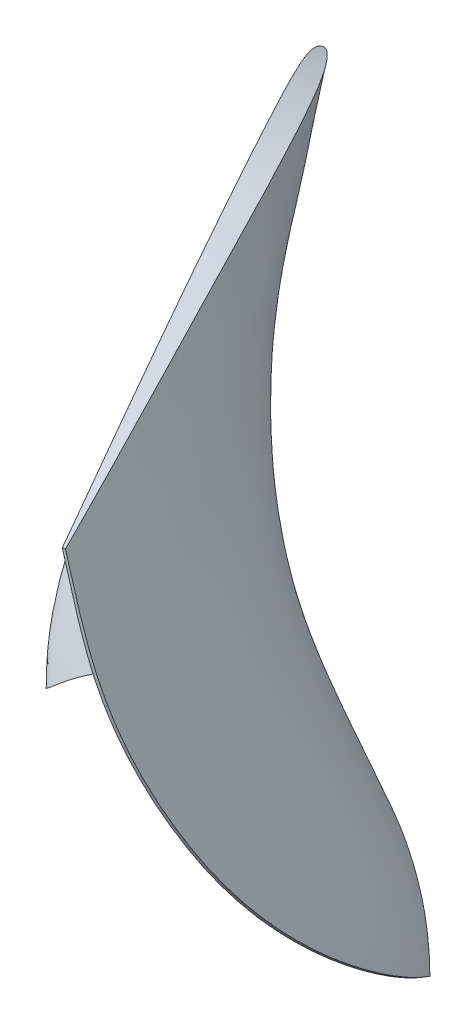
SolidWorks part; units mm, degrees
ref_plane "Ebene vorne" through (0, 0, 0) normal (0, 0, 1) x (1, 0, 0)
ref_plane "Ebene oben" through (0, 0, 0) normal (0, 1, 0) x (1, 0, 0)
ref_plane "Ebene rechts" through (0, 0, 0) normal (1, 0, 0) x (0, 0, -1)
curve "Kurve_0"
curve "Kurve_1"
curve "Kurve_2"
curve "Kurve_3"
curve "Kurve_4"
curve "Kurve_5"
curve "Kurve_6"
curve "Kurve_7"
curve "Kurve_8"
other "Begrenzung-Oberfläche1"
sketch3d "3D-Skizze2"
  spline S0 degree 1 poles (166.6605, 87.5723, 25.6004) (165.8003, 88.2242, 28.7532) knots 0 0 1 1
sketch3d "3D-Skizze3"
  spline S0 degree 1 poles (100.1636, 452.9762, 244.0871) (98.2551, 453.088, 244.6547) knots 0 0 1 1
surface "Oberflächenausfüllung2"
surface "Oberfläche-Zusammenfügen1" [suppressed]
surface "Oberflächenausfüllung4"
surface "Oberflächenausfüllung5"
